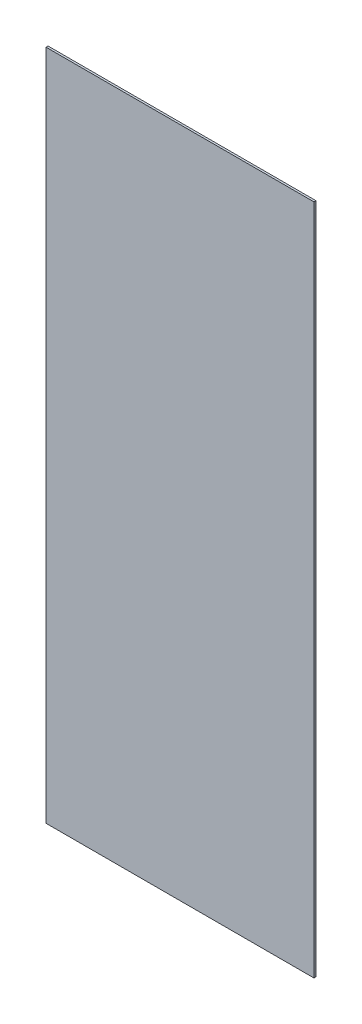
SolidWorks part; units mm, degrees
ref_plane "Plano frontal" through (0, 0, 0) normal (0, 0, 1) x (1, 0, 0)
ref_plane "Plano superior" through (0, 0, 0) normal (0, 1, 0) x (1, 0, 0)
ref_plane "Plano direito" through (0, 0, 0) normal (1, 0, 0) x (0, 0, -1)
sketch "Esboço1" plane through (0, 0, 0) normal (0, 0, 1) x (1, 0, 0)
  line L1 (395, 18) -> (-395, 18)
  line L2 (395, 18) -> (395, 2000)
  line L3 (395, 2000) -> (-395, 2000)
  line L4 (-395, 18) -> (-395, 2000)
extrude "Ressalto-extrusão1" add sketch "Esboço1" against normal blind 6
